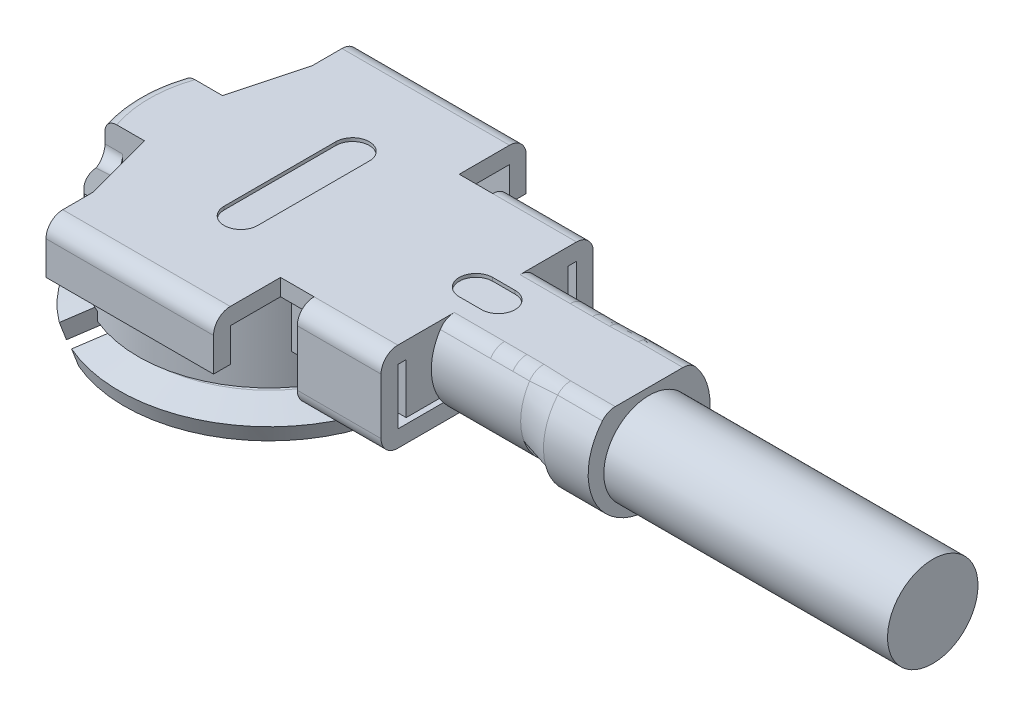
SolidWorks part; units mm, degrees
other "MHF 4 (1.2mm)-1-solid1"
other "MHF 4 (1.2mm)-1-solid2"
other "cable^CSJ-RGFB-200-MHF4 - ASS-1-solid2"
ref_plane "Front Plane" through (0, 0, 0) normal (0, 0, 1) x (1, 0, 0)
ref_plane "Top Plane" through (0, 0, 0) normal (0, 1, 0) x (1, 0, 0)
ref_plane "Right Plane" through (0, 0, 0) normal (1, 0, 0) x (0, 0, -1)
imported_body "Imported4"
imported_body "Imported5"
imported_body "Imported6"
sketch "Sketch1" plane through (0, 0.47, 0) normal (0, 1, 0) x (1, 0, 0)
  line L0 (91, 0.405) -> (-100, 0.405) construction
  line L1 (-96.81, 0.405) -> (91, 0.405)
  line L2 (-96.81, 0.405) -> (-96.81, -0.405)
  line L3 (-96.81, -0.405) -> (91, -0.405)
  line L4 (91, 0.405) -> (91, -0.405)
  line L5 (91, -0.405) -> (91, 0.405) construction
  line L6 (-100, -0.405) -> (91, -0.405) construction
  line L7 (-99.35, 0.3032) -> (-99.35, -0.3032) construction
  dimension "D1" = 2.54
extrude "Cut-Extrude1" cut sketch "Sketch1" against normal blind 2.54
